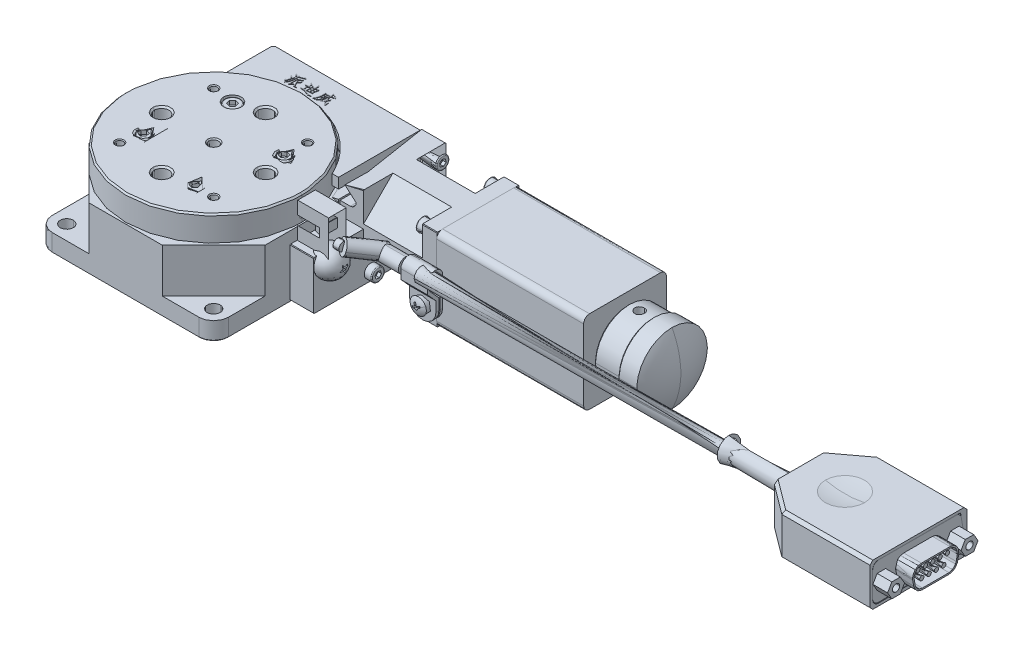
SolidWorks part; units mm, degrees
ref_plane "前视基准面" through (0, 0, 0) normal (0, 0, 1) x (1, 0, 0)
ref_plane "上视基准面" through (0, 0, 0) normal (0, 1, 0) x (1, 0, 0)
ref_plane "右视基准面" through (0, 0, 0) normal (1, 0, 0) x (0, 0, -1)
imported_body "输入1"
imported_body "输入2"
imported_body "曲面-输入1"
imported_body "曲面-输入2"
imported_body "曲面-输入3"
imported_body "曲面-输入4"
imported_body "曲面-输入5"
imported_body "输入3"
imported_body "曲面-输入6"
imported_body "曲面-输入7"
imported_body "曲面-输入8"
imported_body "输入4"
imported_body "输入5"
imported_body "曲面-输入9"
imported_body "输入6"
imported_body "输入7"
imported_body "输入8"
imported_body "输入9"
imported_body "曲面-输入10"
imported_body "曲面-输入11"
imported_body "输入10"
imported_body "输入11"
imported_body "输入12"
imported_body "曲面-输入12"
imported_body "输入13"
imported_body "曲面-输入13"
sketch "草图2" plane through (0, 28.5, 0) normal (0, 1, 0) x (1, 0, 0)
  text T0 "派迪威"
extrude "凸台-拉伸1" add sketch "草图2" along normal blind 0.11 separate body
